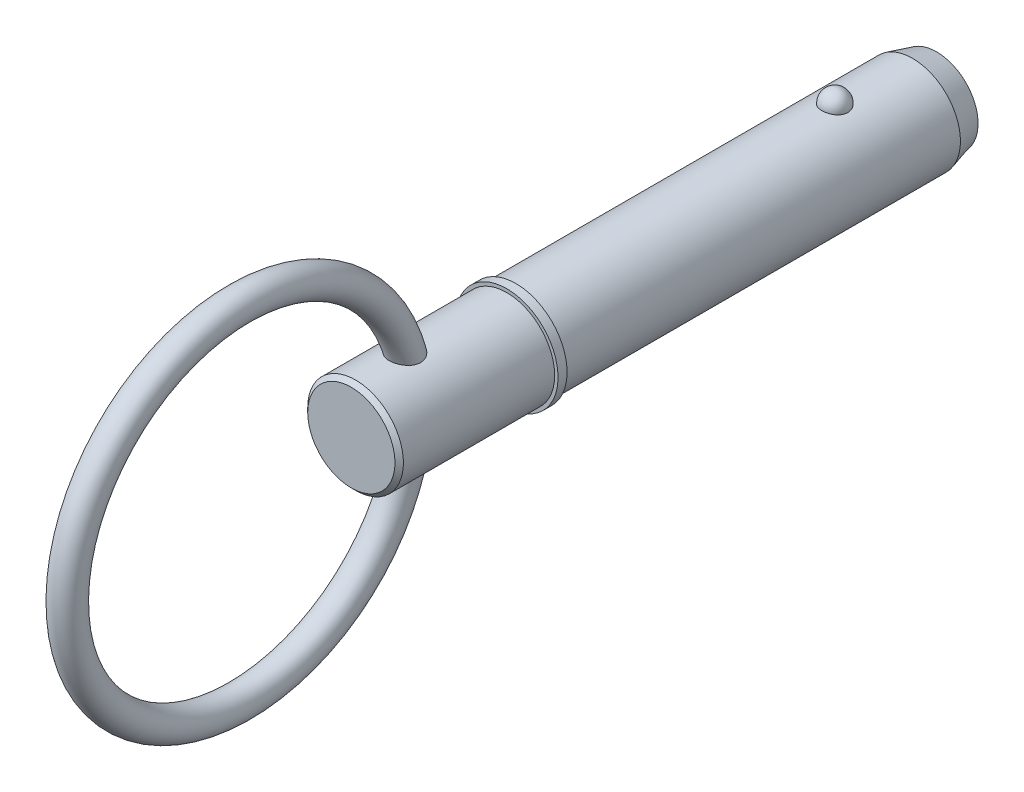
SolidWorks part; units mm, degrees
ref_plane "Front Plane" through (0, 0, 0) normal (0, 0, 1) x (1, 0, 0)
ref_plane "Top Plane" through (0, 0, 0) normal (0, 1, 0) x (1, 0, 0)
ref_plane "Right Plane" through (0, 0, 0) normal (1, 0, 0) x (0, 0, -1)
sketch "Sketch2" plane through (0, 0, 0) normal (0, 0, 1) x (1, 0, 0)
  circle A0 centre (0, 0) radius 7.94
  point P3 (0, 7.94)
  dimension "D1" = 15.88
extrude "Boss-Extrude1" add sketch "Sketch2" along normal blind 50.8
sketch "Sketch3" plane through (0, 0, 0) normal (0, 0, -1) x (-1, 0, 0)
  circle A0 centre (0, 0) radius 7.94
  dimension "D1" = 15.88
extrude "Boss-Extrude2" add sketch "Sketch3" along normal blind 19.05
chamfer "Chamfer1" distance 4 angle 15 1 edges at (-7.94, 0, -19.05)
sketch "Sketch18" plane through (0, 0, 0) normal (1, 0, 0) x (0, 0, -1)
  line L0 (15.05, 7.94) -> (-50.8, 7.94) construction
  line L1 (2.15, 10.09) -> (2.15, 5.79)
  line L2 (-50.8, -7.94) -> (15.05, -7.94) construction
  arc A0 (2.15, 10.09) -> (2.15, 5.79) centre (2.15, 7.94) ccw
  point P4 (0, 7.94)
  dimension "D1" = 18.03
revolve "Revolve1" add sketch "Sketch18" angle 360 about L1
sketch "Sketch19" plane through (0, 0, 0) normal (1, 0, 0) x (0, 0, -1)
  line L0 (-33.7288, 0) -> (-46.4542, 0) construction
sketch "Sketch20" plane through (0, 0, 0) normal (1, 0, 0) x (0, 0, -1)
  line L0 (-50.8, 0) -> (-50.8, 8.5)
  line L1 (-50.8, 7.94) -> (-50.8, -7.94) construction
  line L2 (-50.8, 8.5) -> (-52.3, 8.5)
  line L3 (-52.3, 8.5) -> (-52.3, 0)
  line L4 (-33.7288, 0) -> (-46.4542, 0) construction
  line L5 (-52.3, 0) -> (-50.8, 0)
  dimension "D1" = 8.5
  dimension "D2" = 1.5
revolve "Revolve2" add sketch "Sketch20" angle 360 about L0
sketch "Sketch21" plane through (0, 0, 50.8) normal (0, 0, -1) x (-1, 0, 0)
  circle A0 centre (0, 0) radius 7.94
  dimension "D1" = 15.88
extrude "Boss-Extrude3" add sketch "Sketch21" against normal blind 27.31
chamfer "Chamfer2" distance 0.7 angle 45 1 edges at (-7.94, 0, 78.11)
sketch "Sketch23" plane through (0, 0, 0) normal (1, 0, 0) x (0, 0, -1)
  line L0 (-78.11, 7.24) -> (-78.11, -7.24) construction
  circle A0 centre (-96.685, 0) radius 28.575
  point P2 (-68.11, 0)
  dimension "D1" = 57.15
  dimension "D2" = 10
sketch "Sketch24" plane through (0, 0, 0) normal (0, 1, 0) x (1, 0, 0)
  circle A0 centre (0, -68.11) radius 2.5
  dimension "D1" = 5
sweep "Sweep1" add profiles "Sketch24" path "Sketch23"
